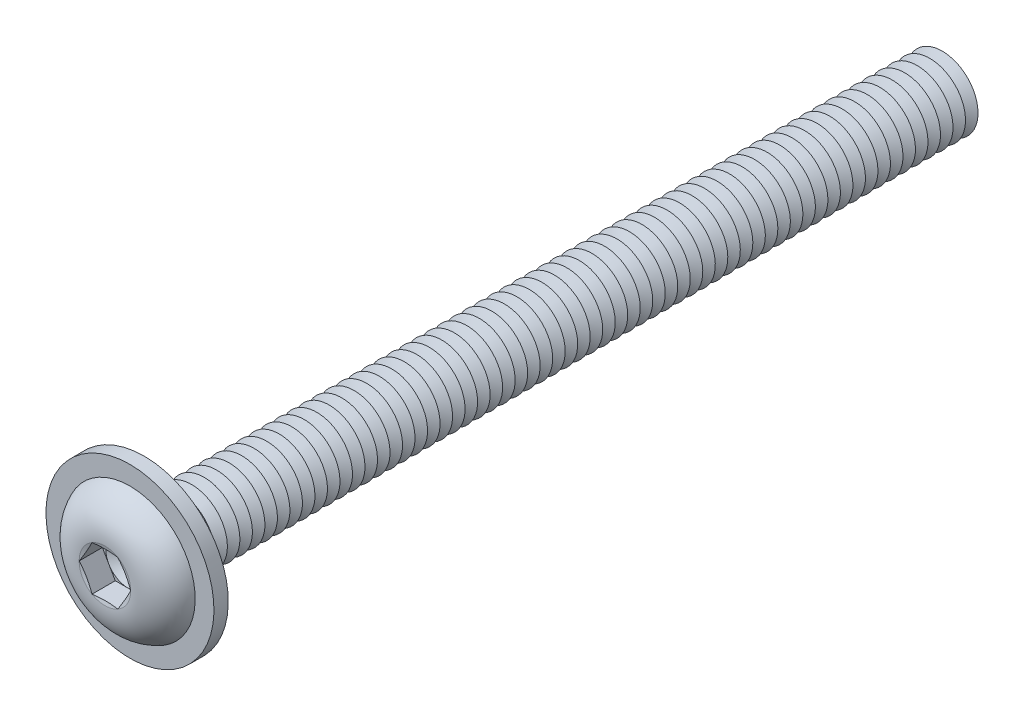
SolidWorks part; units mm, degrees
ref_plane "Front Plane" through (0, 0, 0) normal (0, 0, 1) x (1, 0, 0)
ref_plane "Top Plane" through (0, 0, 0) normal (0, 1, 0) x (1, 0, 0)
ref_plane "Right Plane" through (0, 0, 0) normal (1, 0, 0) x (0, 0, -1)
sketch "Sketch1" plane through (0, 0, 0) normal (1, 0, 0) x (0, 0, -1)
  line L0 (0, 2) -> (0, 3.8)
  line L3 (0, 2) -> (45, 2)
  line L4 (45, 2) -> (45, 0)
  line L5 (45, 0) -> (-2.2, 0) construction
  line L6 (-2.2, 0) -> (45, 0)
  line L7 (-2.2, 1.4434) -> (-2.2, 0.7217) construction
  line L8 (-2.2, 0.7217) -> (-2.2, 0)
  line L9 (-2.2, 1.4434) -> (-2.0066, 0.7217)
  line L10 (-2.0066, 0.7217) -> (-2.2, 0.7217)
  line L11 (45, 0) -> (22.7481, 0) construction
  line L12 (0, 3.8) -> (-2.2, 3.8) construction
  arc A1 (0, 3.8) -> (-2.2, 1.4434) centre (0, 1.5948) ccw
  point P8 (45, 1)
  dimension "D1" = 7.6
  dimension "D2" = 4
  dimension "D3" = 2.2
  dimension "D4" = 2.8868
  dimension "D5" = 45
  dimension "D6" = 15
revolve "Revolve1" add sketch "Sketch1" angle 360 about L5
fillet "Fillet1" radius 0.35 1 edges at (0, 2, 0)
sketch "Sketch2" plane through (0, 0, 0) normal (1, 0, 0) x (0, 0, -1)
  line L0 (44.65, 2) -> (45.35, 2)
  line L1 (45, 2) -> (0.35, 2) construction
  line L2 (45.35, 2) -> (45, 1.3938)
  line L3 (45, -2) -> (45, 2) construction
  line L4 (45, 1.3938) -> (44.65, 2)
  dimension "D1" = 0.7
revolve "Cut-Revolve1" cut sketch "Sketch2" angle 360 about axis through (0, 0, -45) along (0, 0, -1)
pattern_linear "LPattern1" count 64 spacing 0.7 along (0, 0, 1) of "Cut-Revolve1"
sketch "Sketch3" plane through (0, 0, 2.2) normal (0, 0, 1) x (1, 0, 0)
  line L7 (0.7217, 1.25) -> (-0.7217, 1.25)
  line L8 (-0.7217, 1.25) -> (-1.4434, 0)
  line L9 (-1.4434, 0) -> (-0.7217, -1.25)
  line L10 (-0.7217, -1.25) -> (0.7217, -1.25)
  line L11 (0.7217, -1.25) -> (1.4434, 0)
  line L12 (1.4434, 0) -> (0.7217, 1.25)
  circle A0 centre (0, 0) radius 1.25 construction
  circle A3 centre (0, 0) radius 1.4434 construction
extrude "Cut-Extrude1" cut sketch "Sketch3" against normal blind 1.3
sketch "Sketch4" plane through (0, 0, 0.9) normal (0, 0, 1) x (1, 0, 0)
  line L1 (0.7217, 1.25) -> (-0.7217, 1.25) construction
  circle A0 centre (0, 0) radius 1.25
extrude "Cut-Extrude2" cut sketch "Sketch4" against normal through all draft 60
sketch "Sketch5" plane through (0, 0, 0) normal (0, 0, -1) x (-1, 0, 0)
  circle A0 centre (0, 0) radius 4.7
  circle A1 centre (0, 0) radius 2.35
  circle A2 centre (0, 0) radius 2.35 construction
  dimension "D1" = 9.4
extrude "Boss-Extrude1" add sketch "Sketch5" against normal blind 0.8
